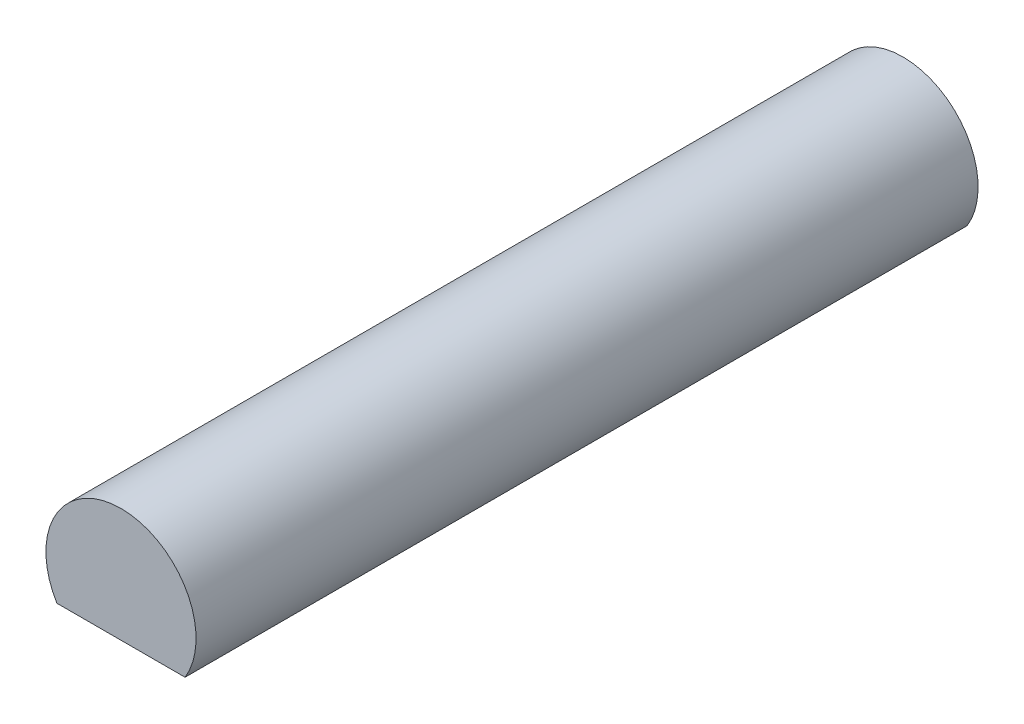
SolidWorks part; units mm, degrees
ref_plane "Front Plane" through (0, 0, 0) normal (0, 0, 1) x (1, 0, 0)
ref_plane "Top Plane" through (0, 0, 0) normal (0, 1, 0) x (1, 0, 0)
ref_plane "Right Plane" through (0, 0, 0) normal (1, 0, 0) x (0, 0, -1)
sketch "Sketch1" plane through (0, 0, 0) normal (0, 0, 1) x (1, 0, 0)
  line L0 (-2.0488, -1.25) -> (2.0488, -1.25)
  arc A0 (2.0488, -1.25) -> (-2.0488, -1.25) centre (0, 0) ccw
  dimension "D1" = 4.8
  dimension "D2" = 1.25
extrude "Boss-Extrude1" add sketch "Sketch1" along normal blind 25 contours A0 L0
